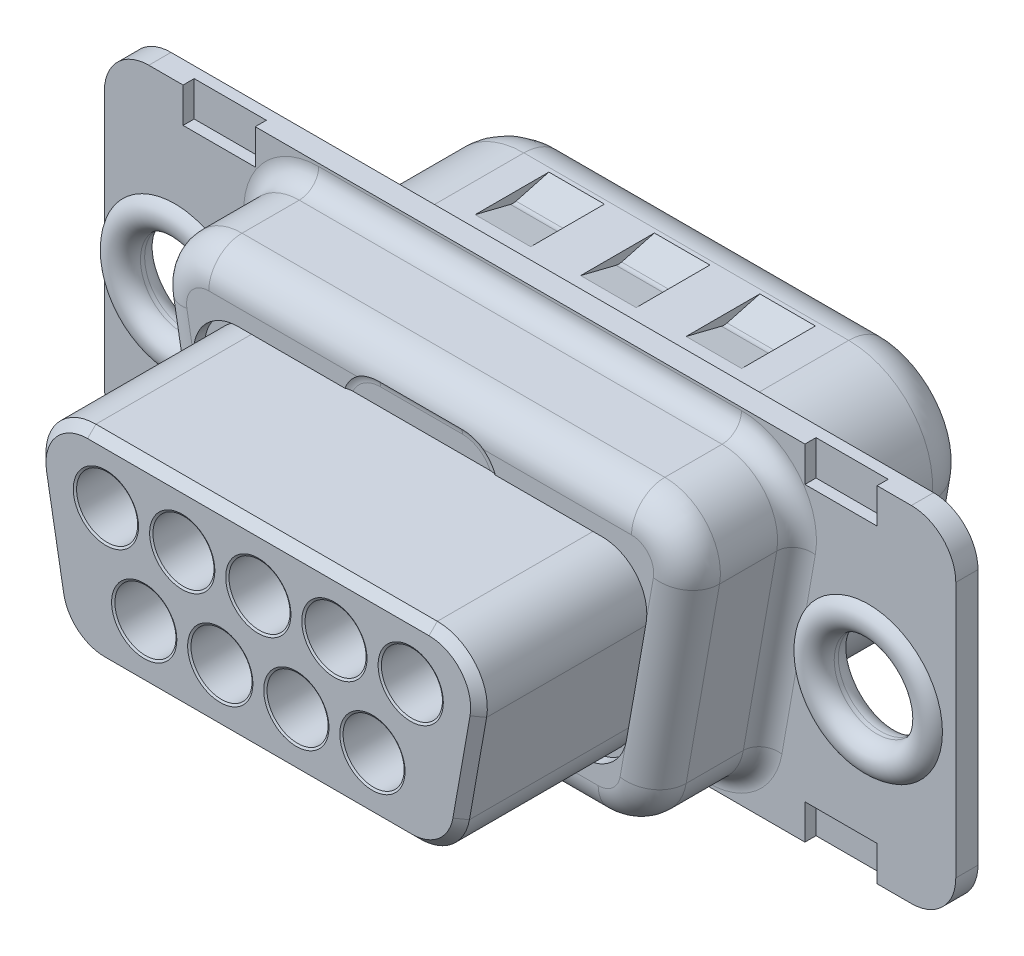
SolidWorks part; units mm, degrees
ref_plane "Front Plane" through (0, 0, 0) normal (0, 0, 1) x (1, 0, 0)
ref_plane "Top Plane" through (0, 0, 0) normal (0, 1, 0) x (1, 0, 0)
ref_plane "Right Plane" through (0, 0, 0) normal (1, 0, 0) x (0, 0, -1)
imported_body "Imported1"
sketch "Sketch1" plane through (0, 0, 0) normal (0, 0, -1) x (-1, 0, 0)
  text T0 "1" font "Century Gothic" height 0.508
extrude "Boss-Extrude1" add sketch "Sketch1" along normal blind 0.127
